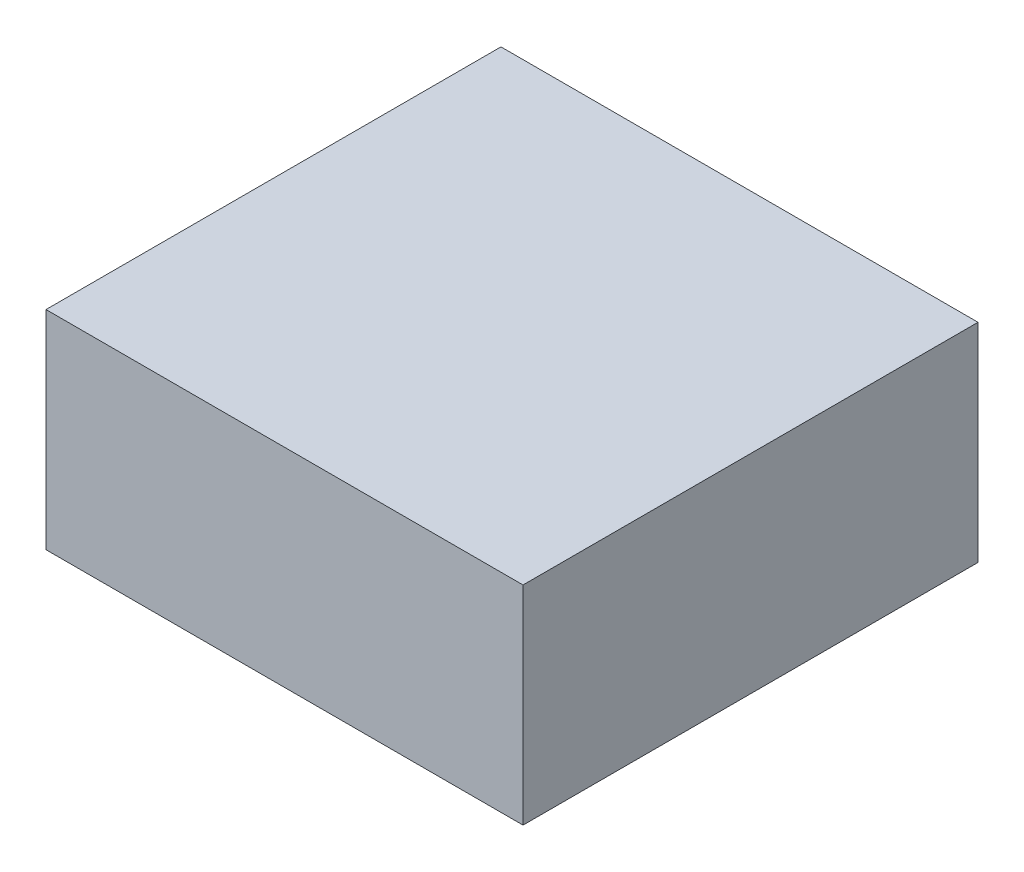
SolidWorks part; units mm, degrees
ref_plane "Front Plane" through (0, 0, 0) normal (0, 0, 1) x (1, 0, 0)
ref_plane "Top Plane" through (0, 0, 0) normal (0, 1, 0) x (1, 0, 0)
ref_plane "Right Plane" through (0, 0, 0) normal (1, 0, 0) x (0, 0, -1)
sketch "Sketch1" plane through (0, 0, 0) normal (0, 0, 1) x (1, 0, 0)
  line L0 (0, -2.8575) -> (0, 2.8575) construction
  line L1 (-6.5532, 2.8575) -> (6.5532, 2.8575)
  line L2 (-6.5532, 2.8575) -> (-6.5532, -2.8575)
  line L3 (-6.5532, -2.8575) -> (6.5532, -2.8575)
  line L4 (6.5532, 2.8575) -> (6.5532, -2.8575)
  dimension "D1" = 13.1064
  dimension "D2" = 5.715
extrude "Extrude1" add sketch "Sketch1" along normal blind 12.5
sketch "Sketch2" plane through (0, 0, 0) normal (0, 0, -1) x (-1, 0, 0)
  line L0 (-6.5532, -2.8575) -> (-6.5532, 2.8575) construction
  line L1 (-4.0532, 0) -> (4.0532, 0)
  line L2 (-5.0532, 0) -> (-5.0532, -1.3575)
  line L3 (-5.0532, -1.3575) -> (5.0532, -1.3575)
  line L4 (5.0532, 0) -> (5.0532, -1.3575)
  line L5 (6.5532, 2.8575) -> (6.5532, -2.8575) construction
  line L6 (6.5532, -2.8575) -> (-6.5532, -2.8575) construction
  line L7 (-5.0532, 0) -> (-5.0532, 1.6425)
  line L8 (-5.0532, 1.6425) -> (5.0532, 1.6425)
  line L9 (5.0532, 1.6425) -> (5.0532, 0)
  line L10 (4.0532, 0) -> (4.0532, 1.1425)
  line L11 (4.0532, 1.1425) -> (-4.0532, 1.1425)
  line L12 (-4.0532, 1.1425) -> (-4.0532, 0)
  dimension "D1" = 1.5
  dimension "D2" = 1.5
  dimension "D3" = 1.5
  dimension "D4" = 1
  dimension "D5" = 1
  dimension "D6" = 0.5
  dimension "D7" = 3
extrude "Cut-Extrude1" cut sketch "Sketch2" against normal blind 10
